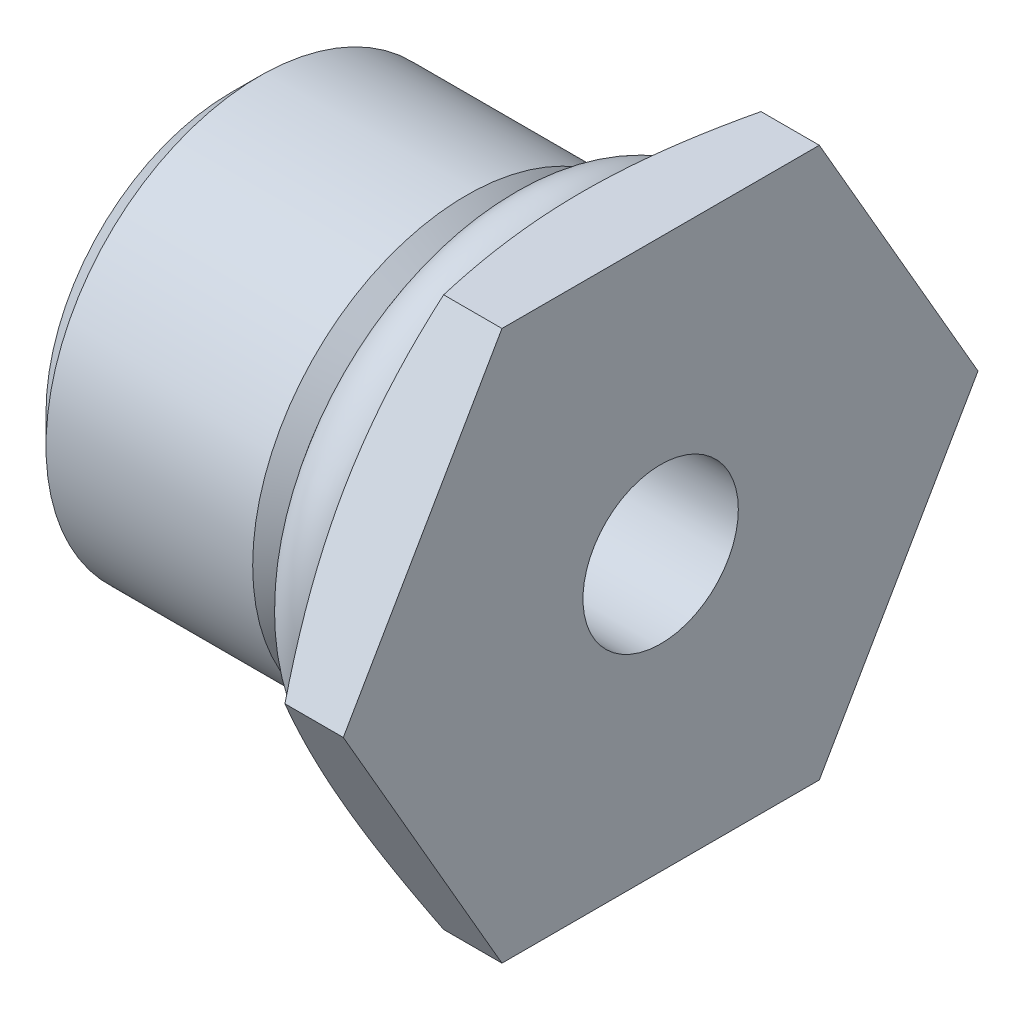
SolidWorks part; units mm, degrees
ref_plane "Front Plane" through (0, 0, 0) normal (0, 0, 1) x (1, 0, 0)
ref_plane "Top Plane" through (0, 0, 0) normal (0, 1, 0) x (1, 0, 0)
ref_plane "Right Plane" through (0, 0, 0) normal (1, 0, 0) x (0, 0, -1)
imported_body "Imported1"
imported_body "Imported2"
sketch "Sketch1" plane through (0, 0, 0) normal (0, 0, 1) x (1, 0, 0)
  line L0 (17.2647, -7.1437) -> (9.6593, -7.1437) construction
  line L1 (19.304, 7.1437) -> (11.176, 7.1437)
  line L2 (19.304, 7.1437) -> (19.304, -7.1437)
  line L3 (19.304, -7.1437) -> (11.176, -7.1437)
  line L4 (11.176, 7.1437) -> (11.176, -7.1437)
  line L5 (9.144, 7.1437) -> (9.144, 3.5719) construction
  dimension "D1" = 2.032
extrude "Cut-Extrude1" cut sketch "Sketch1" against normal through all both and the other way through all
hole_wizard "#10-32 Tapped Hole1" positions "Sketch3" profile "Sketch2" tap size "#10-32" standard "ANSI Inch"
sketch "Sketch3" plane through (11.176, 0, 0) normal (1, 0, 0) x (0, 0, -1)
  point P0 (0, 0)
  point P1 (0, 0)
sketch "Sketch2" plane through (11.176, 0, 0) normal (0, 1, 0) x (0, 0, -1)
  line L0 (0, 0) -> (0, 11.176)
  line L1 (0, 11.176) -> (2.0193, 11.176)
  line L2 (2.0193, 11.176) -> (2.0193, 0)
  line L5 (2.0193, 0) -> (0, 0)
  line L11 (0, -6.35) -> (0, 107.95) construction
  dimension "Thru Tap Drill Dia." = 4.0386
  dimension "Thru Tap Drill Depth" = 11.176
